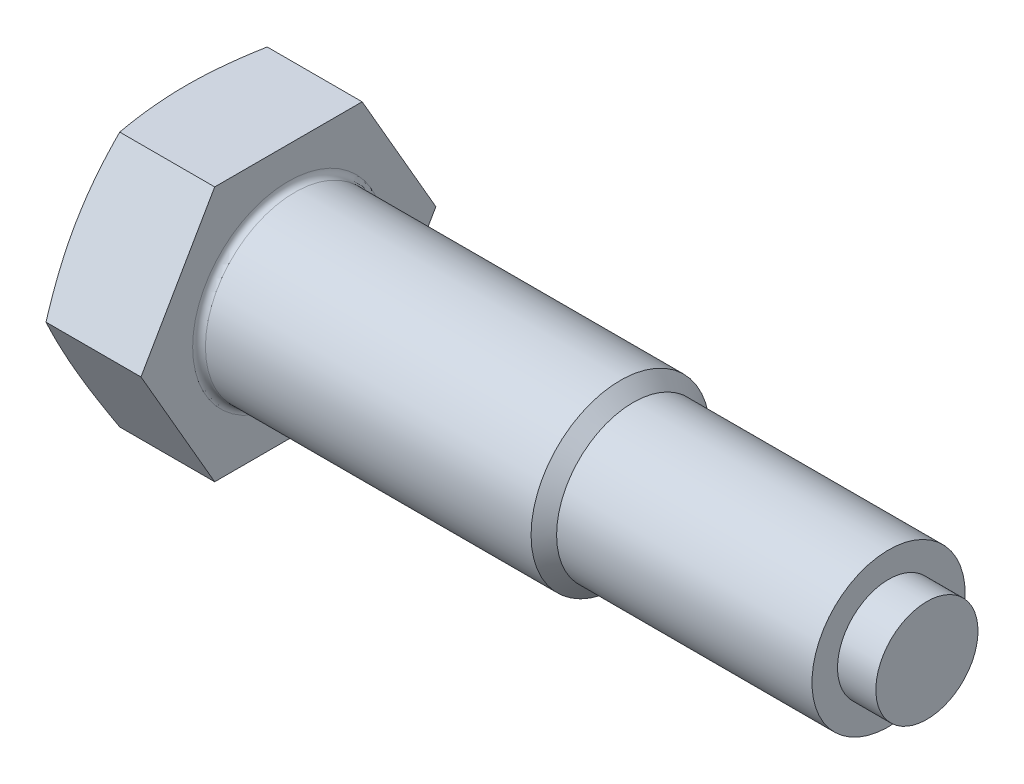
SolidWorks part; units mm, degrees
ref_plane "Front" through (0, 0, 0) normal (0, 0, 1) x (1, 0, 0)
ref_plane "Top" through (0, 0, 0) normal (0, 1, 0) x (1, 0, 0)
ref_plane "Right" through (0, 0, 0) normal (1, 0, 0) x (0, 0, -1)
sketch "Sketch1" plane through (0, 0, 0) normal (1, 0, 0) x (0, 0, -1)
  line L1 (5.7735, 0) -> (2.8868, 5)
  line L2 (2.8868, 5) -> (-2.8868, 5)
  line L3 (-2.8868, 5) -> (-5.7735, 0)
  line L4 (-5.7735, 0) -> (-2.8868, -5)
  line L5 (-2.8868, -5) -> (2.8868, -5)
  line L6 (2.8868, -5) -> (5.7735, 0)
  circle A0 centre (0, 0) radius 5 construction
  dimension "s" = 10
extrude "BaseHead" add sketch "Sketch1" along normal blind 4
sketch "Sketch2" plane through (4, 0, 0) normal (1, 0, 0) x (0, 0, -1)
  circle A0 centre (0, 0) radius 3.5
  dimension "ds" = 7
extrude "Basebody1" add sketch "Sketch2" along normal blind 13
sketch "Sketch4" plane through (17, 0, 0) normal (1, 0, 0) x (0, 0, -1)
  circle A0 centre (0, 0) radius 3
  dimension "d" = 6
extrude "Basebody2" add sketch "Sketch4" along normal offset from surface (12 mm away) 25
sketch "Sketch5" plane through (29, 0, 0) normal (1, 0, 0) x (0, 0, -1)
  circle A0 centre (0, 0) radius 2
  dimension "dp" = 4
extrude "Cut-Extrude1" cut sketch "Sketch5" against normal blind 1.5 flip side to cut
sketch "Sketch6" plane through (0, 0, 0) normal (0, 1, 0) x (1, 0, 0)
  line L0 (0, 5.7735) -> (0.2815, 5.7735)
  line L1 (0.2815, 5.7735) -> (0, 5)
  line L3 (0, 5) -> (0, 5.7735)
  line L4 (-1.5773, 0) -> (3.1205, 0) construction
  line L6 (4, 5.7735) -> (0, 5.7735) construction
  dimension "D1" = 20
  dimension "D2" = 10
revolve "HeadChamfer" cut sketch "Sketch6" angle 360 about L4
fillet "HeadFillet" radius 0.25 1 edges at (4, 0, 3.5)
chamfer "Chamfer1" distance 0.5 angle 45 1 edges at (17, 0, -3)
sketch "Sketch7" plane through (0, 0, 0) normal (0, 1, 0) x (1, 0, 0)
  line L0 (27.125, 3.75) -> (27.875, 3.75)
  line L1 (27.875, 3.75) -> (27.875, 3)
  line L2 (27.875, 3) -> (27.5, 2.3505)
  line L3 (27.5, 2.3505) -> (27.125, 3)
  line L4 (27.125, 3) -> (27.125, 3.75)
  line L6 (27.5, 3) -> (17.5, 3) construction
  line L7 (27.5, -3) -> (27.5, 3) construction
  dimension "d" = 0.75
revolve "Cut-Revolve10" [suppressed] cut sketch "Sketch7" angle 360
pattern_linear "LPattern10" [suppressed] count 12
equation "\"D1@Chamfer1\" =  ( \"ds@Sketch2\" - \"d@Sketch4\" )  / 2"
equation "\"D2@Sketch6\" = \"s@Sketch1\""
equation "\"d@Sketch7\" =  ( \"d@Sketch4\" - \"dn@ThreadCosmetic1\" )  / 2"
equation "\"pitch@LPattern10\" = 1.2 * \"d@Sketch7\""
equation "\"D1@LPattern10\" =  ( \"l@Basebody2\" - \"l3@Basebody1\" )  / \"pitch@LPattern10\"-1"
